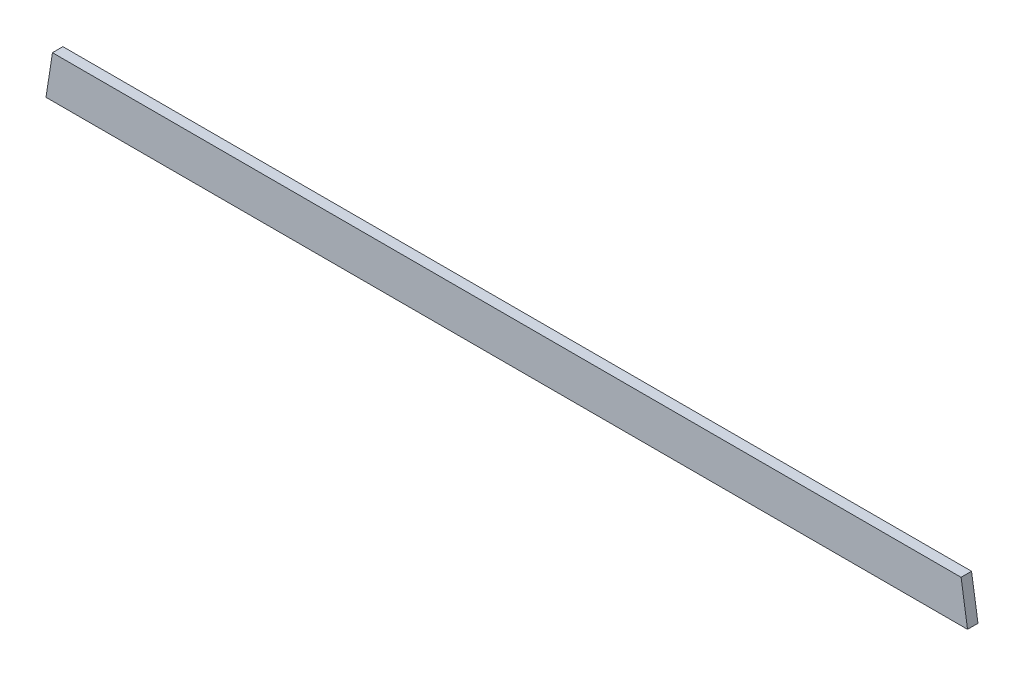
SolidWorks part; units mm, degrees
ref_plane "Front Plane" through (0, 0, 0) normal (0, 0, 1) x (1, 0, 0)
ref_plane "Top Plane" through (0, 0, 0) normal (0, 1, 0) x (1, 0, 0)
ref_plane "Right Plane" through (0, 0, 0) normal (1, 0, 0) x (0, 0, -1)
sketch "Sketch1" plane through (0, 0, 0) normal (0, 0, 1) x (1, 0, 0)
  line L0 (0, -50.8) -> (0, -2032) construction
  line L1 (-473.0229, 50.8) -> (473.0229, 50.8) construction
  line L3 (-713.4762, -50.8) -> (713.4762, -50.8) construction
  line L5 (-812.8, 50.8) -> (812.8, -50.8) construction
  line L6 (-812.8, -50.8) -> (812.8, 50.8) construction
  line L7 (-1219.2, -2032) -> (1219.2, -2032) construction
  line L8 (-914.4, -50.8) -> (914.4, -50.8) construction
  line L9 (-1219.2, -2032) -> (-914.4, -50.8) construction
  line L10 (-1116.4047, -2032) -> (-811.6047, -50.8) construction
  line L11 (-1118.7814, -2047.449) -> (-813.9814, -66.249) construction
  line L12 (0, -50.8) -> (0, 355.6) construction
  line L13 (-12.7, -50.8) -> (-12.7, 355.6) construction
  line L14 (-914.4, -25.4) -> (-12.7, 355.6) construction
  line L15 (-914.4, -50.8) -> (-812.8, -50.8) construction
  line L16 (-914.4, -50.8) -> (-914.4, -25.4) construction
  line L17 (-914.4, -25.4) -> (-812.8, -25.4) construction
  line L19 (-818.427, -95.1454) -> (-12.7, 245.3026) construction
  line L20 (-914.4, -25.4) -> (-812.8, -25.4) construction
  line L21 (-812.8, -25.4) -> (-812.8, -50.8) construction
  line L22 (-874.8556, -118.9885) -> (26.8444, 262.0115) construction
  line L23 (-812.8, -50.8) -> (-811.6047, -50.8) construction
  line L24 (-811.6047, -50.8) -> (-818.427, -95.1454) construction
  line L25 (-12.7, 355.6) -> (-12.7, 245.3026) construction
  line L26 (-713.4762, -50.8) -> (-473.0229, 50.8) construction
  line L27 (713.4762, -50.8) -> (473.0229, 50.8) construction
  line L28 (12.7, -50.8) -> (12.7, 355.6) construction
  line L29 (914.4, -50.8) -> (914.4, -25.4) construction
  line L30 (914.4, -25.4) -> (12.7, 355.6) construction
  line L31 (914.4, -25.4) -> (812.8, -25.4) construction
  line L32 (812.8, -25.4) -> (812.8, -50.8) construction
  line L33 (818.427, -95.1454) -> (12.7, 245.3026) construction
  line L34 (1219.2, -2032) -> (914.4, -50.8) construction
  line L35 (1116.4047, -2032) -> (811.6047, -50.8) construction
  point P0 (0, 0)
  point P11 (0, -2032)
  point P13 (0, -50.8)
  dimension "D1" = 101.6
  dimension "D2" = 1625.6
  dimension "D3" = 1981.2
  dimension "D4" = 2438.4
  dimension "D5" = 1828.8
  dimension "D7" = 406.4
  dimension "D9" = 25.4
  dimension "D10" = 101.6
  dimension "D6" = 101.6
  dimension "D8" = 12.7
  dimension "D11" = 101.6
sketch "Sketch2" plane through (0, 0, 0) normal (0, 0, 1) x (1, 0, 0)
  line L0 (-1117.6, -1371.6) -> (1117.6, -1371.6)
  line L3 (-1101.9692, -1270) -> (1101.9692, -1270)
  line L4 (-1219.2, -2032) -> (1219.2, -2032) construction
  line L8 (-1014.8047, -1270) -> (1014.8047, -1270) construction
  line L9 (-1014.8047, -1371.6) -> (1014.8047, -1371.6) construction
  line L10 (1219.2, -2032) -> (914.4, -50.8) construction
  line L11 (-1219.2, -2032) -> (-914.4, -50.8) construction
  line L12 (1117.6, -1371.6) -> (1101.9692, -1270)
  line L13 (-1101.9692, -1270) -> (-1117.6, -1371.6)
  dimension "D2" = 762
  dimension "D1" = 101.6
extrude "Boss-Extrude1" add sketch "Sketch2" along normal blind 25.4 contours L3 L12 L0 L13
